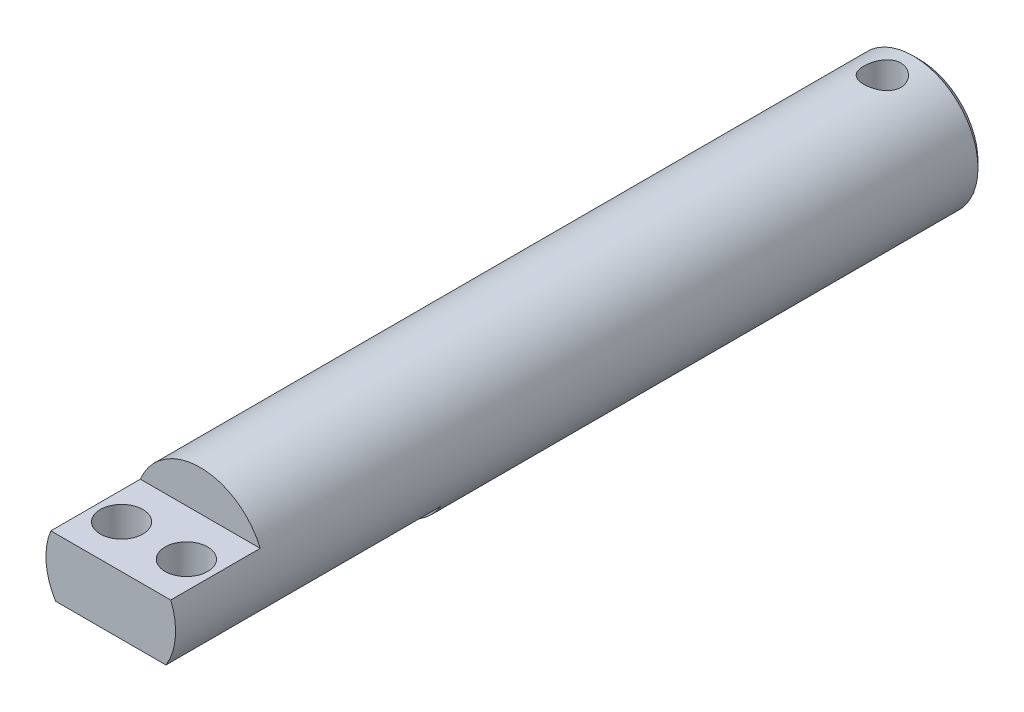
SolidWorks part; units mm, degrees
ref_plane "Plan1" through (0, 0, 0) normal (0, 0, 1) x (1, 0, 0)
ref_plane "Plan2" through (0, 0, 0) normal (0, 1, 0) x (1, 0, 0)
ref_plane "Plan3" through (0, 0, 0) normal (1, 0, 0) x (0, 0, -1)
sketch "Esquisse1" plane through (0, 0, 0) normal (0, 0, 1) x (1, 0, 0)
  circle A0 centre (0, 0) radius 10.5
  dimension "D1" = 21
extrude "Base-Extrusion" add sketch "Esquisse1" along normal blind 131
sketch "Esquisse2" plane through (0, 0, 131) normal (0, 0, 1) x (1, 0, 0)
  line L0 (-9.7082, 4) -> (9.7082, 4)
  circle A1 centre (0, 0) radius 10.5
  arc A2 (9.7082, 4) -> (-9.7082, 4) centre (0, 0) ccw
  dimension "D2" = 6.5
  dimension "D1" = 0
extrude "Enlèv. mat.-Extru.1" cut sketch "Esquisse2" against normal blind 14.5
sketch "Esquisse3" plane through (0, 0, 131) normal (0, 0, 1) x (1, 0, 0)
  line L0 (-8.9443, -5.5) -> (8.9443, -5.5)
  line L1 (9.7082, 4) -> (-9.7082, 4)
  arc A1 (-9.7082, 4) -> (9.7082, 4) centre (0, 0) ccw
  arc A2 (-8.9443, -5.5) -> (8.9443, -5.5) centre (0, 0) ccw
  dimension "D2" = 5
  dimension "D1" = 0
extrude "Enlèv. mat.-Extru.2" cut sketch "Esquisse3" against normal blind 44.5
sketch "Esquisse4" plane through (0, 4, 0) normal (0, 1, 0) x (-1, 0, 0)
  line L0 (-29, 124) -> (31, 124) construction
  line L1 (9.7082, 131) -> (-9.7082, 131) construction
  line L2 (0, 68.9008) -> (0, 137.1118) construction
  line L3 (0, 131) -> (0, 86.5) construction
  line L4 (-5.25, 120) -> (-5.25, 129) construction
  circle A0 centre (-5.25, 124) radius 3.45
  circle A1 centre (5.25, 124) radius 3.45
  dimension "D3" = 6.9
  dimension "D1" = 7
  dimension "D2" = 5.25
extrude "Enlèv. mat.-Extru.3" cut sketch "Esquisse4" against normal through all
ref_plane "Plan4" through (0, 10.5, 0) normal (0, 1, 0) x (-1, 0, 0)
sketch "Esquisse5" plane through (0, 10.5, 0) normal (0, 1, 0) x (-1, 0, 0)
  line L0 (0, 26.519) -> (0, -10.953) construction
  line L1 (0, 131) -> (0, 86.5) construction
  line L2 (-16, 6) -> (19, 6) construction
  line L3 (-10.5, 0) -> (10.5, 0) construction
  circle A0 centre (0, 6) radius 3
  dimension "D2" = 6
  dimension "D1" = 6
extrude "Enlèv. mat.-Extru.4" cut sketch "Esquisse5" against normal through all
chamfer "Chanfrein1" distance 1 angle 45
